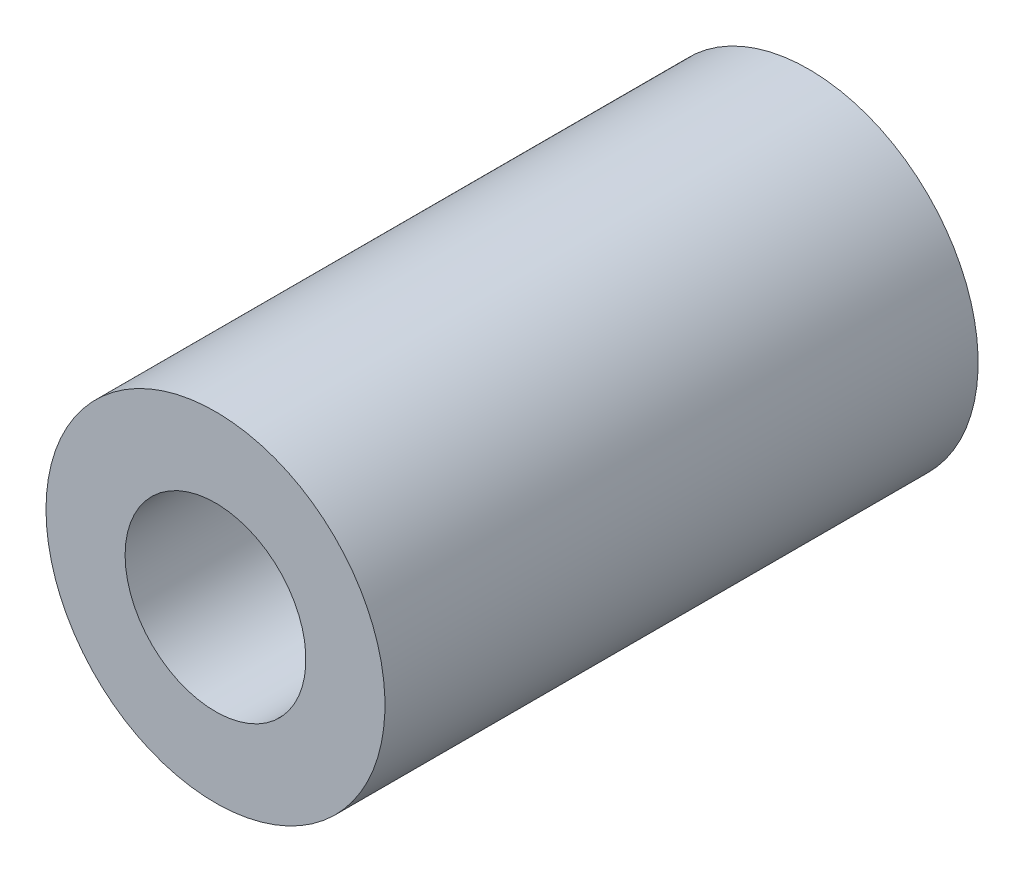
SolidWorks part; units mm, degrees
ref_plane "Plan de face" through (0, 0, 0) normal (0, 0, 1) x (1, 0, 0)
ref_plane "Plan de dessus" through (0, 0, 0) normal (0, 1, 0) x (1, 0, 0)
ref_plane "Plan de droite" through (0, 0, 0) normal (1, 0, 0) x (0, 0, -1)
sketch "Esquisse1" plane through (0, 0, 0) normal (0, 0, 1) x (1, 0, 0)
  circle A0 centre (0, 0) radius 3
  circle A1 centre (0, 0) radius 1.6
extrude "Boss.-Extru.1" add sketch "Esquisse1" along normal blind 10.5
